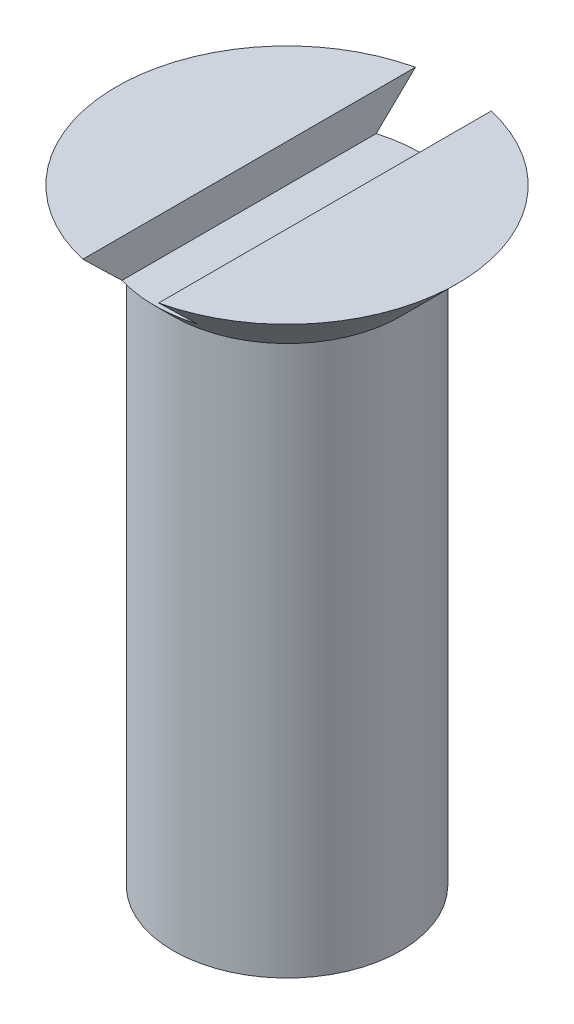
SolidWorks part; units mm, degrees
ref_plane "Front Plane" through (0, 0, 0) normal (0, 0, 1) x (1, 0, 0)
ref_plane "Top Plane" through (0, 0, 0) normal (0, 1, 0) x (1, 0, 0)
ref_plane "Right Plane" through (0, 0, 0) normal (1, 0, 0) x (0, 0, -1)
sketch "Sketch1" plane through (0, 0, 0) normal (0, 0, 1) x (1, 0, 0)
  line L0 (0, 0) -> (3, 1.7321)
  line L1 (3, 1.7321) -> (3, 16.2321)
  line L2 (3, 16.2321) -> (4.5, 17.7321)
  line L3 (4.5, 17.7321) -> (0, 17.7321)
  line L4 (0, 0) -> (0, 17.7321)
  line L5 (0, 0) -> (0, -3.5007) construction
  dimension "D1" = 60
  dimension "D2" = 6
  dimension "D3" = 45
  dimension "D4" = 14.5
  dimension "D5" = 4.5
revolve "Revolve1" add sketch "Sketch1" angle 360 about L5
sketch "Sketch2" plane through (0, 17.7321, 0) normal (0, 1, 0) x (1, 0, 0)
  line L1 (-1, -5.2546) -> (1, -5.2546)
  line L2 (-1, -5.2546) -> (-1, 5.2546)
  line L3 (-1, 5.2546) -> (1, 5.2546)
  line L4 (1, -5.2546) -> (1, 5.2546)
  line L5 (-1, -5.2546) -> (1, 5.2546) construction
  line L6 (-1, 5.2546) -> (1, -5.2546) construction
  point P0 (0, 0)
  dimension "D1" = 2
extrude "Cut-Extrude1" cut sketch "Sketch2" against normal blind 1
